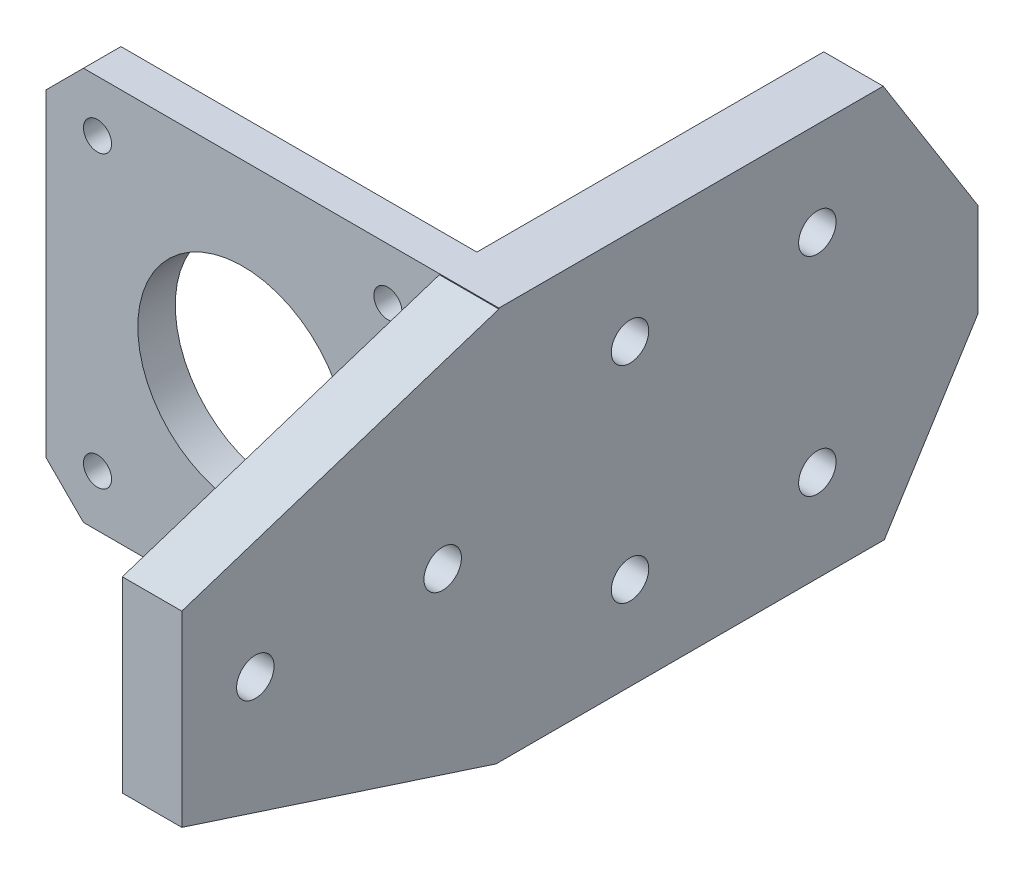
SolidWorks part; units mm, degrees
ref_plane "Front Plane" through (0, 0, 0) normal (0, 0, 1) x (1, 0, 0)
ref_plane "Top Plane" through (0, 0, 0) normal (0, 1, 0) x (1, 0, 0)
ref_plane "Right Plane" through (0, 0, 0) normal (1, 0, 0) x (0, 0, -1)
sketch "Sketch1" plane through (0, 0, 0) normal (0, 0, 1) x (1, 0, 0)
  line L8 (-38, 42) -> (-42, 38)
  line L9 (-42, 38) -> (-42, 4)
  line L10 (-42, 4) -> (-38, 0)
  line L17 (-38, 42) -> (0, 42)
  line L19 (-38, 0) -> (0, 0)
  line L20 (0, 42) -> (0, 0)
  circle A1 centre (-21, 21) radius 16.5
  circle A3 centre (-36.5, 36.5) radius 1.5
  circle A4 centre (-5.5, 36.5) radius 1.5
  circle A5 centre (-5.5, 5.5) radius 1.5
  circle A6 centre (-36.5, 5.5) radius 1.5
  circle A8 centre (-21, 21) radius 11.2
  point P23 (-21, 21)
  dimension "D2" = 3
  dimension "D3" = 38
  dimension "D4" = 5.6569
  dimension "D5" = 5.5
  dimension "D6" = 22.4
  dimension "D7" = 33
  dimension "D8" = 5.5
  dimension "D9" = 21
  dimension "D10" = 21
  dimension "D11" = 4
  dimension "D13" = 38
  dimension "D14" = 38
  dimension "D15" = 42
  dimension "D16" = 42
  dimension "D17" = 5.5
  dimension "D19" = 21
  dimension "D20" = 42
  dimension "D23" = 38
  dimension "D1" = 4
extrude "Boss-Extrude1" add sketch "Sketch1" along normal blind 4
sketch "Sketch4" plane through (0, 0, -47.15) normal (0, 0, -1) x (-1, 0, 0)
  line L2 (-6.35, 11.5) -> (-6.35, 18.12)
  line L3 (0, 4) -> (0, 38)
  line L4 (0, 21) -> (-6.35, 21) construction
  line L6 (0, 42) -> (-6.35, 42)
  line L7 (0, 42) -> (0, 0)
  line L8 (0, 0) -> (-6.35, 0)
  line L9 (-6.35, 42) -> (-6.35, 0)
  line L10 (0, 42) -> (-6.35, 0) construction
  line L11 (0, 0) -> (-6.35, 42) construction
  line L12 (38, 0) -> (4, 0) construction
  line L13 (63.4299, -81.9178) -> (97.4299, -81.9178) construction
  point P5 (-3.175, 21)
  dimension "D1" = 101.4299
  dimension "D2" = 104.6049
  dimension "D3" = 85.9178
  dimension "D4" = 93.4178
  dimension "D5" = 100.0378
  dimension "D6" = 119.9178
extrude "Boss-Extrude2" add sketch "Sketch4" against normal blind 85 contours L6 L9 L2 L8 M16
sketch "Sketch5" plane through (0, 0, 0) normal (-1, 0, 0) x (0, 0, 1)
  line L0 (12, 20.9057) -> (-69.889, 20.9057) construction
  line L1 (37.85, 42) -> (-47.15, 42) construction
  line L2 (0, 4) -> (0, 38) construction
  line L3 (37.85, 42) -> (37.85, 0) construction
  line L4 (3.9241, 10.9057) -> (37.85, 10.9057)
  line L6 (3.7862, 30.9057) -> (37.85, 30.9057)
  line L7 (37.85, 10.9057) -> (37.85, 30.9057)
  line L8 (-47.15, 15.9057) -> (-37.15, 0)
  line L9 (-47.15, 25.9057) -> (-37.0314, 42)
  line L10 (0, 31) -> (0, 38) construction
  line L12 (24.453, -142.5843) -> (37.85, -142.5843)
  line L13 (0, 31) -> (0, 42)
  line L14 (0, 42) -> (37.85, 42)
  line L15 (37.85, -142.5843) -> (37.85, 42)
  line L17 (4, 42) -> (4, 0) construction
  line L18 (4, -0.0943) -> (3.7097, 42)
  line L19 (-47.15, 42) -> (-47.15, 0)
  line L20 (37.85, 42) -> (-47.15, 42)
  line L21 (37.85, 0) -> (37.85, 42)
  line L22 (-47.15, 0) -> (37.85, 0)
  line L23 (-47.15, 42) -> (-47.15, 0) construction
  line L24 (37.85, 42) -> (-47.15, 42) construction
  line L25 (37.85, 0) -> (37.85, 42) construction
  line L27 (4, -0.0943) -> (37.85, 10.9057)
  line L28 (3.7097, 42) -> (37.85, 30.9057)
  line L31 (37.85, 42) -> (4, 42) construction
  line L33 (-47.15, 0) -> (37.85, 0)
  line L34 (0, 0) -> (0, 42)
  line L35 (0, 42) -> (-47.15, 42)
  line L36 (-47.15, 42) -> (-47.15, 0)
  line L39 (0, 42) -> (-47.15, 42)
  line L40 (-47.15, 42) -> (-47.15, 0)
  line L42 (0, 0) -> (0, 42)
  line L43 (-47.15, 0) -> (37.85, 0)
  circle A1 centre (10, 20.9057) radius 2
  circle A4 centre (-10, 31.9057) radius 2
  circle A5 centre (-30, 32) radius 2
  circle A8 centre (30, 20.9057) radius 2
  circle A9 centre (-30, 9.8113) radius 2
  circle A10 centre (-10, 9.9057) radius 2
  dimension "D2" = 4
  dimension "D3" = 11
  dimension "D4" = 20
  dimension "D5" = 4
  dimension "D6" = 10
  dimension "D12" = 35.8977
  dimension "D13" = 33.85
  dimension "D14" = 5
  dimension "D15" = 10
  dimension "D16" = 19.0109
  dimension "D11" = 4
  dimension "D7" = 42.0943
  dimension "D10" = 35.5925
  dimension "D17" = 33.9259
  dimension "D8" = 0
  dimension "D9" = 0
extrude "Cut-Extrude1" cut sketch "Sketch5" against normal blind 85
sketch "Sketch6" plane through (0, 0, 0) normal (-1, 0, 0) x (0, 0, 1)
  circle A2 centre (30, 20.9057) radius 3.8
  circle A3 centre (10, 20.9057) radius 3.8
  circle A4 centre (30, 20.9057) radius 4.8
  circle A5 centre (10, 20.9057) radius 4.8
  circle A6 centre (-10, 31.9057) radius 4.8
  circle A8 centre (-30, 9.9057) radius 2
  circle A10 centre (-10, 31.9057) radius 2
  circle A12 centre (-30, 31.9057) radius 2
  circle A14 centre (-10, 9.9057) radius 2
  circle A15 centre (-10, 9.9057) radius 4.8
  circle A16 centre (-30, 9.9057) radius 4.8
  circle A17 centre (-30, 31.9057) radius 4.8
  dimension "D2" = 9.6
  dimension "D7" = 7.85
  dimension "D3" = 4
  dimension "D4" = 4
  dimension "D5" = 7.6
  dimension "D6" = 7.6
  dimension "D8" = 4
  dimension "D9" = 4
  dimension "D10" = 27.85
  dimension "D11" = 10
  dimension "D12" = 10
  dimension "D13" = 47.85
  dimension "D14" = 47.85
  dimension "D15" = 67.85
  dimension "D16" = 67.85
  dimension "D17" = 21
  dimension "D18" = 21
  dimension "D19" = 1
  dimension "D20" = 1
  dimension "D1" = 1
extrude "Cut-Extrude2" cut sketch "Sketch6" against normal blind 2.5 contours A3 M12 | A5 A3 | A15 A14 | A16 A8 | A17 A12 | A6 A10 | A4
